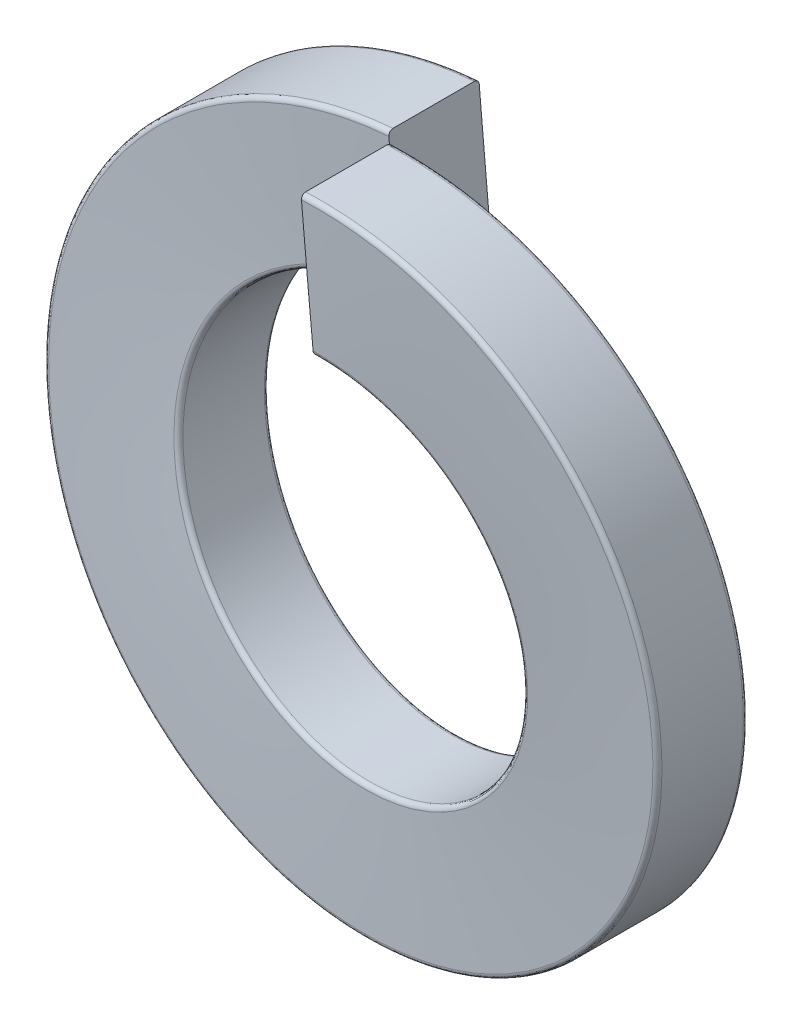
SolidWorks part; units mm, degrees
ref_plane "Front Plane" through (0, 0, 0) normal (0, 0, 1) x (1, 0, 0)
ref_plane "Top Plane" through (0, 0, 0) normal (0, 1, 0) x (1, 0, 0)
ref_plane "Right Plane" through (0, 0, 0) normal (1, 0, 0) x (0, 0, -1)
sketch "Sketch1" plane through (0, 0, 0) normal (0, 0, 1) x (1, 0, 0)
  circle A0 centre (0, 0) radius 2.2098
  circle A1 centre (0, 0) radius 3.7211
  dimension "OD" = 7.4422
  dimension "ID" = 4.4196
sketch "Sketch2" plane through (0, 0, 0) normal (1, 0, 0) x (0, 0, -1)
  line L0 (0, 0) -> (0, 3.7211) construction
  line L1 (0, 3.7211) -> (0, -3.7211) construction
  line L4 (0.1016, 3.7211) -> (1.1176, 3.7211)
  line L5 (1.1176, 3.7211) -> (1.1176, 2.2098)
  line L6 (1.1176, 2.2098) -> (0.1016, 2.2098)
  line L7 (0.1016, 2.2098) -> (0.1016, 3.7211)
  point P6 (0, 2.2098)
  point P14 (0, -3.7211)
ref_plane "Plane1" through (0, 0, -1.1176) normal (0, 0, 1) x (1, 0, 0)
sketch "Sketch3" plane through (0, 0, -1.1176) normal (0, 0, 1) x (1, 0, 0)
  circle A0 centre (0, 0) radius 3.7211 construction
  circle A1 centre (0, 0) radius 3.7211
curve "Helix/Spiral1"
sketch "Sketch4" plane through (0, 0, 0) normal (1, 0, 0) x (0, 0, -1)
  line L0 (0.1016, 2.2098) -> (0.1016, 3.7211) construction
  line L1 (1.1176, 2.2098) -> (0.1016, 2.2098) construction
  line L2 (1.1176, 3.7211) -> (1.1176, 2.2098) construction
  line L3 (0.1016, 3.7211) -> (1.1176, 3.7211) construction
  line L4 (0.1016, 2.2098) -> (0.1016, 3.7211)
  line L5 (1.1176, 2.2098) -> (0.1016, 2.2098)
  line L6 (1.1176, 3.7211) -> (1.1176, 2.2098)
  line L7 (0.1016, 3.7211) -> (1.1176, 3.7211)
sweep "Sweep1" add profiles "Sketch4" path "Helix/Spiral1"
fillet "Fillet1" radius 0.0508 4 edges
sketch "Sketch5" plane through (0, 0, 0) normal (0, 0, 1) x (1, 0, 0)
  line L2 (0, 0) -> (-0.0649, 3.7205) construction
  line L3 (0, 3.7211) -> (0.1304, 2.2059)
  line L4 (-0.1299, 3.7188) -> (0, 2.2098)
  line L5 (-0.1299, 3.7188) -> (0, 0) construction
  line L6 (0, 0) -> (0, 3.7211) construction
  line L7 (0, 2.2098) -> (0, 0)
  line L8 (0, 0) -> (0.1304, 0)
  line L9 (0.1304, 0) -> (0.1304, 2.2059)
  circle A0 centre (0, 0) radius 3.7211 construction
  arc A1 (-0.1299, 3.7188) -> (0, 3.7211) centre (0, 0) cw
  circle A2 centre (0, 0) radius 2.2098 construction
  dimension "D1" = 2
extrude "Cut-Extrude1" cut sketch "Sketch5" against normal through all both and the other way through all
ref_plane "Contact Plane1" through (0, 0, 1.0158) normal (0, 0, 1) x (1, 0, 0)
ref_plane "Contact Plane2" through (0, 0, -1.1173) normal (0, 0, 1) x (1, 0, 0)
equation "\"D1@Sketch2\" = \"Thickness@Sketch2\" * 0.1"
equation "\"D4@Helix/Spiral1\" = \"Thickness@Sketch2\" + \"D1@Sketch2\""
equation "\"D1@Fillet1\"=\"D1@Sketch2\"*0.5"
